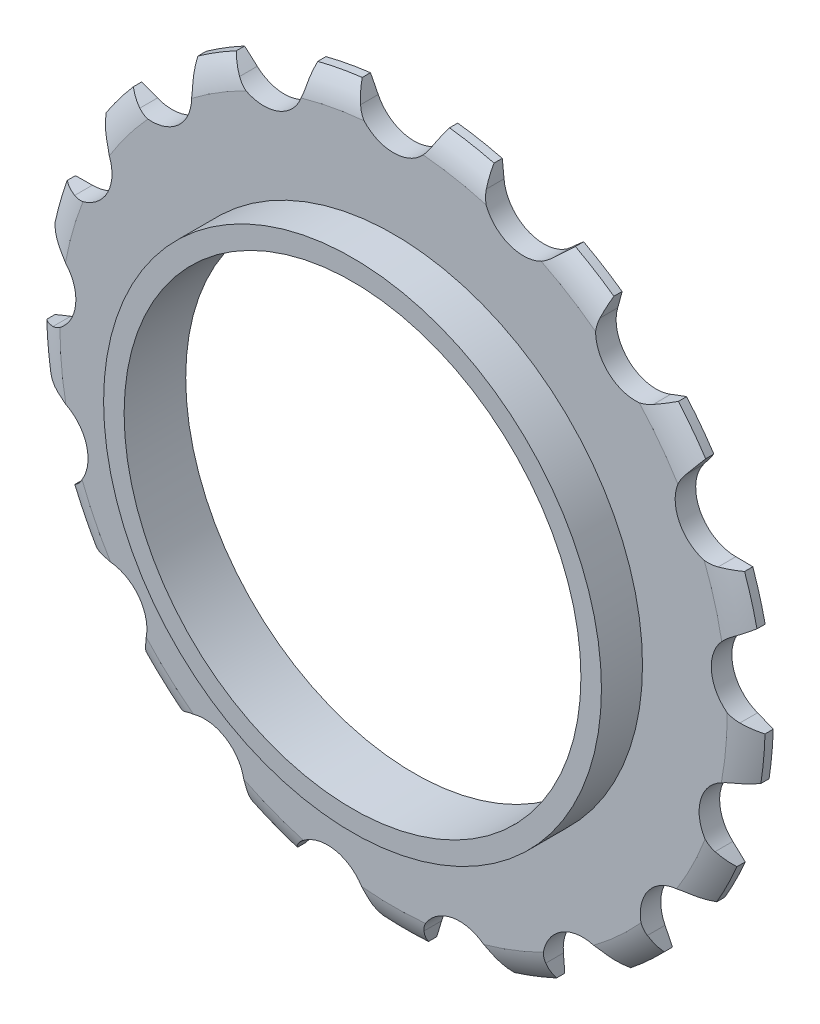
SolidWorks part; units mm, degrees
ref_plane "Front" through (0, 0, 0) normal (0, 0, 1) x (1, 0, 0)
ref_plane "Top" through (0, 0, 0) normal (0, 1, 0) x (1, 0, 0)
ref_plane "Right" through (0, 0, 0) normal (1, 0, 0) x (0, 0, -1)
sketch "Sketch1" plane through (0, 0, 0) normal (0, 0, 1) x (1, 0, 0)
  line L0 (0, 31.1) -> (0, 0) construction
  line L1 (0, 31.1) -> (0, 35) construction
  line L2 (0, 35) -> (0, 37.85) construction
  circle A0 centre (0, 0) radius 31.1 construction
  circle A3 centre (0, 0) radius 35 construction
  arc A4 (-5.7825, 37.4057) -> (-3.4968, 33.2731) centre (-49.0456, 10.7797) cw
  arc A5 (5.7825, 37.4057) -> (3.4968, 33.2731) centre (49.0456, 10.7797) ccw
  arc A6 (-3.4968, 33.2731) -> (3.4968, 33.2731) centre (0, 35) ccw
  arc A10 (5.7825, 37.4057) -> (-5.7825, 37.4057) centre (0, 0) ccw
  point P4 (6.3238, 34.424)
  dimension "D1" = 2.85
  dimension "D2" = 3.9
  dimension "D3" = 50.8
  dimension "D5" = 11.5649
  dimension "D6" = 70
  dimension "D4" = 6.35
sketch "Sketch2" plane through (0, 0, 0) normal (1, 0, 0) x (0, 0, -1)
  line L0 (-1.2, 22.25) -> (0.8, 22.25)
  line L1 (0, 35) -> (0, -35) construction
  line L5 (-1.2, 22.25) -> (-1.2, 32.5)
  line L7 (0, 35) -> (0.8, 35)
  line L8 (0.8, 22.25) -> (0.8, 35)
  arc A0 (-1.2, 32.5) -> (0, 35) centre (4.1982, 31.4469) cw
  dimension "D4" = 2
  dimension "D7" = 5.5
  dimension "D1" = 22.25
  dimension "D5" = 2.5
  dimension "D6" = 0.8
ref_axis "Axis1" through (0, 0, -80.9) along (0, 0, 1)
revolve "Revolve1" add sketch "Sketch2" angle 360 about axis through (0, 0, -80.9) along (0, 0, 1)
extrude "Extrude1" cut sketch "Sketch1" against normal through all and the other way through all
pattern_circular "CirPattern1" count 17 over 360 about axis through (0, 0, 0) along (0, 0, 1) of "Extrude1"
sketch "Sketch4" plane through (0, 0, 1.2) normal (0, 0, 1) x (1, 0, 0)
  circle A0 centre (0, 0) radius 22.25 construction
  circle A1 centre (0, 0) radius 22.25
extrude "Extrude-Thin1" add sketch "Sketch4" along normal blind 4 thin
